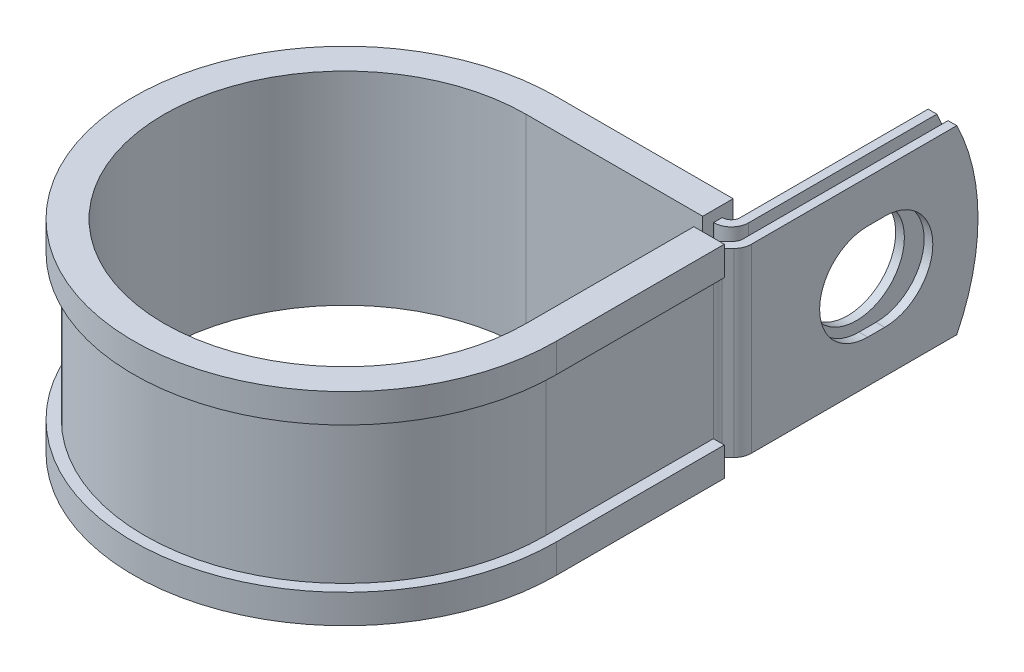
SolidWorks part; units mm, degrees
ref_plane "Front Plane" through (0, 0, 0) normal (0, 0, 1) x (1, 0, 0)
ref_plane "Top Plane" through (0, 0, 0) normal (0, 1, 0) x (1, 0, 0)
ref_plane "Right Plane" through (0, 0, 0) normal (1, 0, 0) x (0, 0, -1)
sketch "Sketch1" plane through (0, 0, 0) normal (0, 1, 0) x (1, 0, 0)
  line L0 (0, 26.924) -> (24.8083, 26.924)
  line L1 (26.924, 0) -> (26.924, 23.5115)
  line L2 (27.2467, 58.7248) -> (27.2467, 29.3624)
  line L3 (27.6382, 25.2357) -> (28.4644, 26.0619)
  line L5 (28.8215, 26.924) -> (28.8215, 58.7248)
  arc A0 (0, 26.924) -> (26.924, 0) centre (0, 0) ccw
  arc A1 (27.6382, 25.2357) -> (26.924, 23.5115) centre (29.3624, 23.5115) ccw
  arc A2 (28.4644, 26.0619) -> (28.8215, 26.924) centre (27.6023, 26.924) ccw
  arc A3 (24.8083, 26.924) -> (27.2467, 29.3624) centre (24.8083, 29.3624) ccw
extrude "Extrude-Thin1" add sketch "Sketch1" along normal mid plane 25.4 thin
sketch "Sketch2" plane through (26.0275, 0, 0) normal (-1, 0, 0) x (0, 0, 1)
  line L0 (-58.7248, 12.7) -> (-58.7248, -12.7) construction
  line L1 (0, 12.7) -> (0, -12.7) construction
  circle A0 centre (-44.45, 0) radius 6.7437
  point P2 (-58.7248, 0)
extrude "Cut-Extrude1" cut sketch "Sketch2" against normal up to surface (1.2192 mm away)
sketch "Sketch3" plane through (30.0407, 0, 0) normal (1, 0, 0) x (0, 0, -1)
  line L0 (43.2562, 0) -> (45.6438, 0) construction
  line L1 (43.2562, 6.7437) -> (45.6438, 6.7437)
  line L2 (43.2562, -6.7437) -> (45.6438, -6.7437)
  line L3 (58.7248, 12.7) -> (58.7248, -12.7) construction
  arc A0 (43.2562, 6.7437) -> (43.2562, -6.7437) centre (43.2562, 0) ccw
  arc A1 (45.6438, -6.7437) -> (45.6438, 6.7437) centre (45.6438, 0) ccw
  point P3 (44.45, 0)
  point P8 (58.7248, 0)
  point P11 (36.5125, 0)
  point P12 (52.3875, 0)
extrude "Cut-Extrude2" cut sketch "Sketch3" against normal up to surface (1.2192 mm away)
sketch "Sketch4" plane through (26.0275, 0, 0) normal (-1, 0, 0) x (0, 0, 1)
  line L0 (-58.7248, 12.7) -> (-58.7248, -12.7)
  line L1 (-58.7248, 12.7) -> (-55.7475, 12.7)
  line L2 (-58.7248, 12.7) -> (-29.3624, 12.7) construction
  line L3 (-58.7248, -12.7) -> (-55.7475, -12.7)
  line L4 (-58.7248, -12.7) -> (-29.3624, -12.7) construction
  arc A0 (-55.7475, 12.7) -> (-55.7475, -12.7) centre (-30.1498, 0) ccw
extrude "Cut-Extrude3" cut sketch "Sketch4" against normal through all contours A0 M4 M5 | A0 L0 M2
ref_plane "Plane1" through (0, 0, -23.5115) normal (0, 0, -1) x (-1, 0, 0)
ref_plane "Plane2" through (24.7575, 0, 0) normal (-1, 0, 0) x (0, 0, 1)
sketch "Sketch5" plane through (0, 0, -23.5115) normal (0, 0, -1) x (-1, 0, 0)
  line L0 (-28.1432, 12.7) -> (-26.924, 12.7)
  line L1 (-28.1432, 12.7) -> (-28.1432, -12.7) construction
  line L3 (-26.924, 12.7) -> (-26.924, -12.7)
  line L4 (-26.924, -12.7) -> (-28.1432, -12.7)
  line L5 (-28.1432, -12.7) -> (-28.1432, -10.16)
  line L6 (-28.1432, 12.7) -> (-28.1432, 10.16)
  line L7 (-29.6672, 14.224) -> (-29.6672, 10.16)
  line L8 (-29.6672, 14.224) -> (-25.4, 14.224)
  line L9 (-25.4, 14.224) -> (-25.4, -14.224)
  line L10 (-25.4, -14.224) -> (-29.6672, -14.224)
  line L11 (-29.6672, -14.224) -> (-29.6672, -10.16)
  line L12 (-29.6672, 10.16) -> (-28.1432, 10.16)
  line L13 (-28.1432, -10.16) -> (-29.6672, -10.16)
sketch "Sketch6" plane through (0, 12.7, 0) normal (0, 1, 0) x (1, 0, 0)
  line L0 (25.4, 0) -> (25.4, 23.5115)
  line L1 (25.4, 23.5115) -> (29.6672, 23.5115) construction
  line L2 (24.7575, 6.9878) -> (24.7575, -6.9878) construction
  line L5 (0, 25.4) -> (24.7575, 25.4)
  arc A0 (0, 25.4) -> (25.4, 0) centre (0, 0) ccw
sweep "Sweep1" add profiles "Sketch5" path "Sketch6"
equation "\"D4@Sketch5\" = \"D1@Extrude-Thin1\""
equation "\"D5@Sketch5\" = \"D5@Extrude-Thin1\""
equation "\"D1@Sketch3\" = \"D2@Sketch2\""
equation "\"D7@Sketch1\" = \"D3@Sketch2\" + \"D1@Sketch3\""
equation "\"D1@Sketch1\" = \"D1@Sketch6\" + 2 * \"D3@Sketch5\""
equation "\"D1@Sketch4\" = ( \"D1@Extrude-Thin1\" + .125 ) * 2"
equation "\"D9@Sketch1\"= \"D5@Extrude-Thin1\""
equation "\"D8@Sketch1\"= 2 * \"D5@Extrude-Thin1\""
equation "\"D2@Sketch1\" = 2 * \"D5@Extrude-Thin1\""
equation "\"D2@Sketch3\" = \"D1@Sketch2\""
